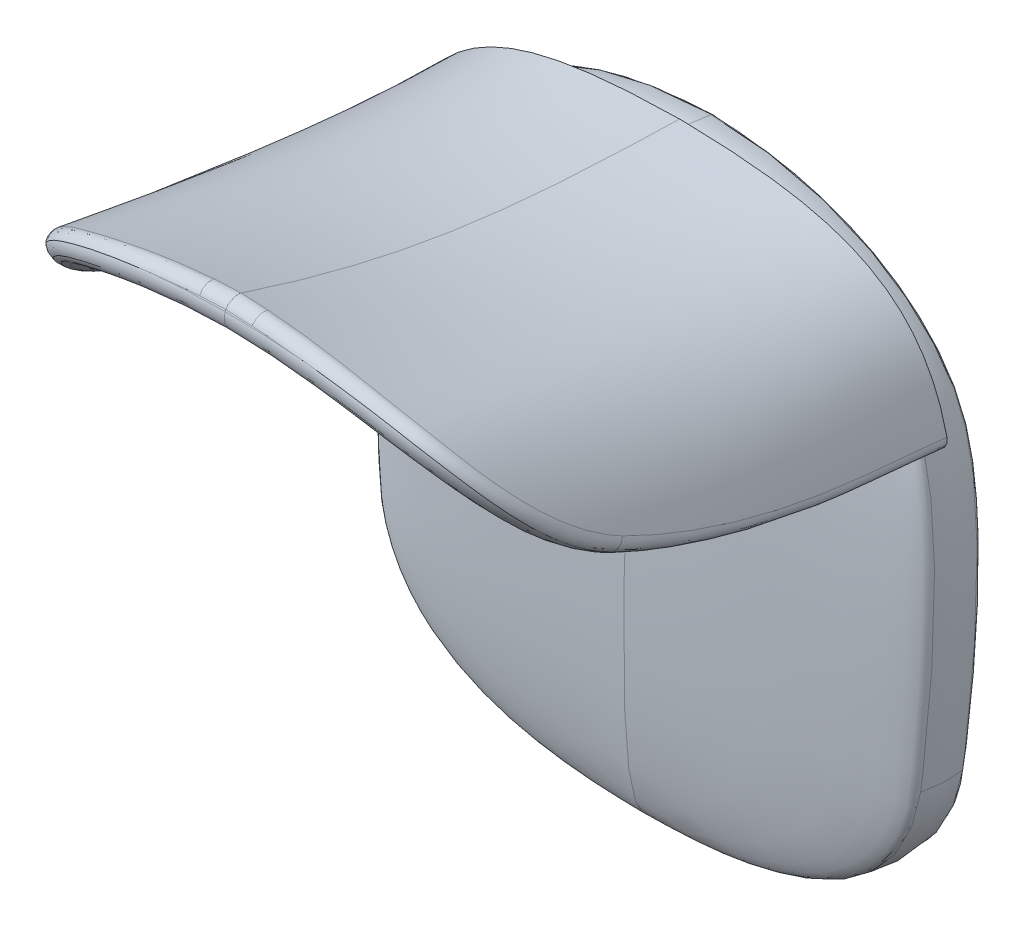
SolidWorks part; units mm, degrees
ref_plane "Plan de face" through (0, 0, 0) normal (0, 0, 1) x (1, 0, 0)
ref_plane "Plan de dessus" through (0, 0, 0) normal (0, 1, 0) x (1, 0, 0)
ref_plane "Plan de droite" through (0, 0, 0) normal (1, 0, 0) x (0, 0, -1)
imported_body "Directionnelle3"
delete or keep bodies "Corps-Supprimer/Garder 1" [suppressed] type delete bodies bodies 104 105 152 153 154 163 162 161 157 156 155 151 113 160 166 165 167 164 175 116 174 159 108 115 107 111 112 110 176 169 168 170 172 171 173 109 114 158
delete or keep bodies "Corps-Supprimer/Garder 2" type delete bodies bodies 126 127 128 129 130 131 132 133 134 135 136 137 138 139 140 141 142 143 144 145 146 147 148 149 150 151 152 153 154 155 156 157 158 159 160 161 162 163 164 165
delete or keep bodies "Corps-Supprimer/Garder 3" type delete bodies bodies 121 122 123 124 125
delete or keep bodies "Corps-Supprimer/Garder 4" type delete bodies bodies 117 118 119 120
delete or keep bodies "Corps-Supprimer/Garder 5" type delete bodies bodies 105
delete or keep bodies "Corps-Supprimer/Garder 6" type delete bodies bodies 107 108 109 110 111 112 113 114 115 116
delete or keep bodies "Corps-Supprimer/Garder 7" type delete bodies bodies 104
ref_plane "Plan1" through (1.1931, 22.5494, 539.676) normal (-0.0022, -0.0417, -0.9991) x (-1, 0.0001, 0.0022)
